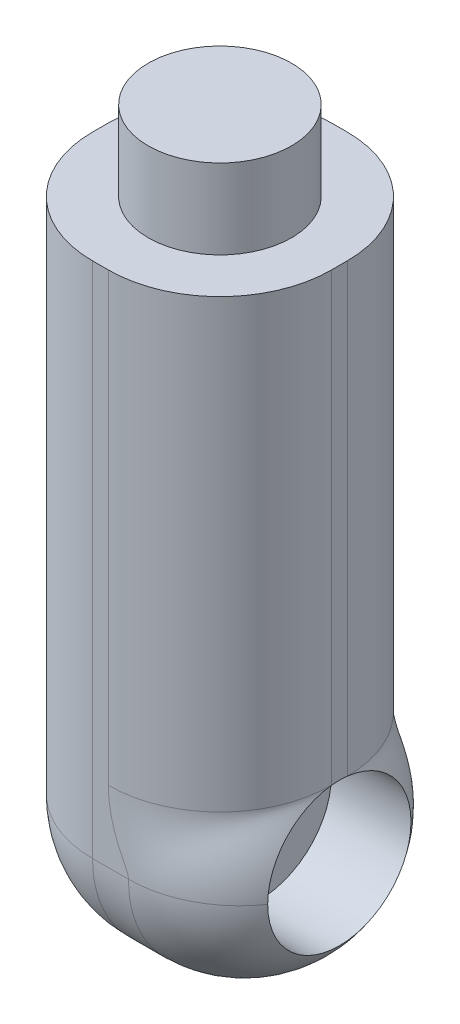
SolidWorks part; units mm, degrees
ref_plane "Plan de face" through (0, 0, 0) normal (0, 0, 1) x (1, 0, 0)
ref_plane "Plan de dessus" through (0, 0, 0) normal (0, 1, 0) x (1, 0, 0)
ref_plane "Plan de droite" through (0, 0, 0) normal (1, 0, 0) x (0, 0, -1)
sketch "Esquisse1" plane through (0, 0, 0) normal (1, 0, 0) x (0, 0, -1)
  line L1 (0, 0) -> (150, 0)
  line L2 (0, 0) -> (0, 400)
  line L3 (0, 400) -> (150, 400)
  line L4 (150, 0) -> (150, 400)
  dimension "D1" = 400
  dimension "D2" = 150
extrude "Boss.-Extru.1" add sketch "Esquisse1" along normal blind 150
sketch "Esquisse2" plane through (0, 400, 0) normal (0, 1, 0) x (1, 0, 0)
  line L0 (75, 150) -> (75, 0) construction
  line L1 (150, 150) -> (0, 150) construction
  line L2 (150, 0) -> (0, 0) construction
  circle A0 centre (75, 75) radius 45
extrude "Boss.-Extru.2" add sketch "Esquisse2" along normal blind 50
sketch "Esquisse3" plane through (150, 0, 0) normal (1, 0, 0) x (0, 0, -1)
  line L0 (0, 0) -> (0, 75) construction
  line L1 (0, 400) -> (0, 0) construction
  line L2 (0, 75) -> (150, 75) construction
  line L3 (150, 0) -> (150, 400) construction
  circle A0 centre (75, 75) radius 45
  dimension "D1" = 75
extrude "Enlèv. mat.-Extru.1" cut sketch "Esquisse3" against normal blind 50
sketch "Esquisse4" plane through (150, 0, 0) normal (1, 0, 0) x (0, 0, -1)
  line L0 (-31.066, 75) -> (0, 75)
  line L1 (181.066, 75) -> (150, 75)
  circle A0 centre (75, 75) radius 75
  arc A2 (150, 0) -> (-31.066, 75) centre (75, 75) cw
  arc A3 (150, 0) -> (181.066, 75) centre (75, 75) ccw
extrude "Enlèv. mat.-Extru.2" cut sketch "Esquisse4" against normal through all contours A3 L1 M7 | A0 M6 M7 | A2 M6 | A0 M5 M6 | A2 L0 M5
fillet "Congé2" radius 70 5 edges at (0, 237.5, 0) (0, 0, -75) (150, 237.5, -150) (0, 237.5, -150) (150, 237.5, 0)
